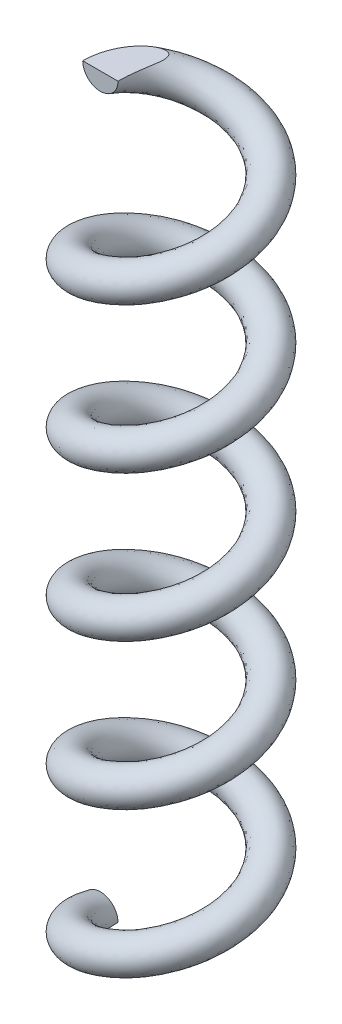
SolidWorks part; units mm, degrees
ref_plane "Front Plane" through (0, 0, 0) normal (0, 0, 1) x (1, 0, 0)
ref_plane "Top Plane" through (0, 0, 0) normal (0, 1, 0) x (1, 0, 0)
ref_plane "Right Plane" through (0, 0, 0) normal (1, 0, 0) x (0, 0, -1)
sketch "Sketch1" plane through (0, 0, 0) normal (0, 0, 1) x (1, 0, 0)
  line L1 (-24, -71.5) -> (-38, -71.5) construction
  circle A0 centre (-38, -71.5) radius 3.5
  dimension "D3" = 7
  dimension "D2" = 14
sketch "Sketch5" plane through (0, 0, 0) normal (0, 0, 1) x (1, 0, 0)
  line L0 (-24, -71.5) -> (-24, 72.8804)
  line L3 (-29, 72.8804) -> (-19, 72.8804) construction
sweep "Sweep3" add profiles "Sketch1" path "Sketch5" parameters "D4"=1800
ref_plane "Plane3" through (0, 72.8804, 0) normal (0, 1, 0) x (1, 0, 0)
ref_plane "Plane4" through (0, -71.5, 0) normal (0, 1, 0) x (1, 0, 0)
other "SurfaceCut1"
other "SurfaceCut2"
